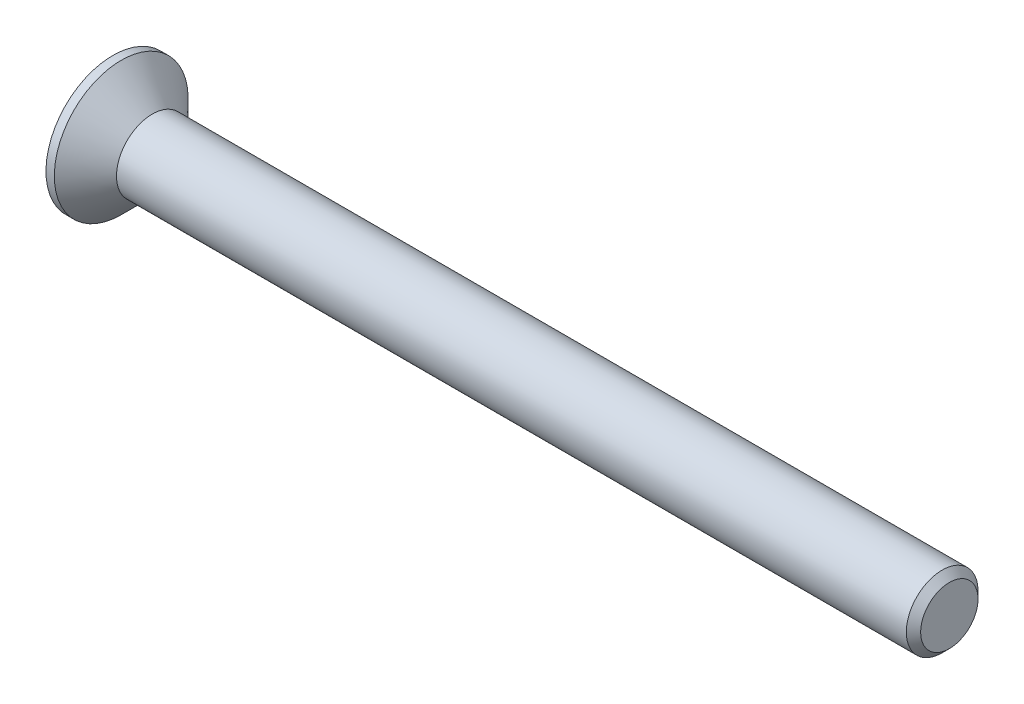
SolidWorks part; units mm, degrees
ref_plane "Front Plane" through (0, 0, 0) normal (0, 0, 1) x (1, 0, 0)
ref_plane "Top Plane" through (0, 0, 0) normal (0, 1, 0) x (1, 0, 0)
ref_plane "Right Plane" through (0, 0, 0) normal (1, 0, 0) x (0, 0, -1)
sketch "Sketch1" plane through (0, 0, 0) normal (0, 0, 1) x (1, 0, 0)
  line L1 (-1.65, 2.8) -> (-1.65, 0)
  line L2 (-1.65, 0) -> (33.35, 0)
  line L3 (33.35, 0) -> (33.35, 1.5)
  line L4 (33.35, 1.5) -> (0, 1.5)
  line L5 (-1.65, 2.8) -> (-1.3, 2.8)
  line L6 (-1.3, 2.8) -> (0, 1.5)
  dimension "D1" = 1.5
  dimension "D2" = 45
  dimension "D3" = 1.65
  dimension "D4" = 35
  dimension "D5" = 2.8
revolve "Revolve1" add sketch "Sketch1" angle 360 about L2
chamfer "Chamfer1" distance 0.3 angle 45 1 edges at (33.35, -1.5, 0)
sketch "Sketch2" plane through (-1.65, 0, 0) normal (-1, 0, 0) x (0, 0, 1)
  line L0 (-0.365, 1.45) -> (0.365, 1.45)
  line L1 (0.365, 1.45) -> (0.365, 0.365)
  line L2 (0.365, 0.365) -> (1.45, 0.365)
  line L3 (1.45, 0.365) -> (1.45, -0.365)
  line L4 (1.45, -0.365) -> (0.365, -0.365)
  line L5 (0.365, -0.365) -> (0.365, -1.45)
  line L6 (0.365, -1.45) -> (-0.365, -1.45)
  line L7 (-0.365, -1.45) -> (-0.365, -0.365)
  line L8 (-0.365, -0.365) -> (-1.45, -0.365)
  line L9 (-1.45, -0.365) -> (-1.45, 0.365)
  line L10 (-1.45, 0.365) -> (-0.365, 0.365)
  line L11 (-0.365, 0.365) -> (-0.365, 1.45)
  point P2 (0, 1.45)
  point P14 (0, -1.45)
  point P15 (1.45, 0)
  point P16 (-1.45, 0)
  dimension "D1" = 2.9
  dimension "D2" = 0.73
extrude "Cut-Extrude1" cut sketch "Sketch2" against normal blind 1.25
